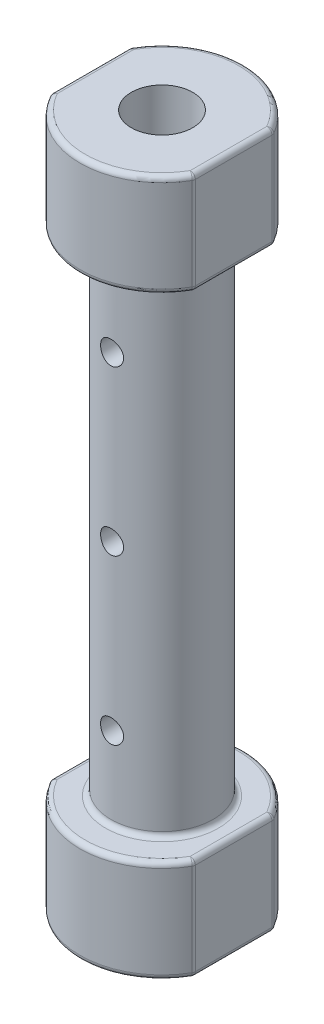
SolidWorks part; units mm, degrees
ref_plane "Front Plane" through (0, 0, 0) normal (0, 0, 1) x (1, 0, 0)
ref_plane "Top Plane" through (0, 0, 0) normal (0, 1, 0) x (1, 0, 0)
ref_plane "Right Plane" through (0, 0, 0) normal (1, 0, 0) x (0, 0, -1)
sketch "Sketch1" plane through (0, 0, 0) normal (0, 1, 0) x (1, 0, 0)
  circle A0 centre (0, 0) radius 7.9375
  dimension "D1" = 15.875
extrude "Boss-Extrude1" add sketch "Sketch1" along normal mid plane 76.2
sketch "Sketch2" plane through (0, 38.1, 0) normal (0, 1, 0) x (1, 0, 0)
  circle A0 centre (0, 0) radius 12.7
  dimension "D1" = 25.4
extrude "Boss-Extrude2" add sketch "Sketch2" along normal blind 15.875
mirror "Mirror1" about plane through (0, 0, 0) normal (0, 1, 0) of "Boss-Extrude2"
hole_wizard "3/8 (0.375) Diameter Hole1" positions "Sketch4" profile "Sketch3" hole size "3/8" standard "ANSI Inch"
sketch "Sketch4" plane through (0, 53.975, 0) normal (0, 1, 0) x (1, 0, 0)
  point P0 (0, 0)
sketch "Sketch3" plane through (0, 53.975, 0) normal (1, 0, 0) x (0, 0, 1)
  line L0 (0, 0) -> (0, 107.95)
  line L1 (0, 107.95) -> (4.7625, 107.95)
  line L2 (4.7625, 107.95) -> (4.7625, 0)
  line L5 (4.7625, 0) -> (0, 0)
  line L11 (0, -6.35) -> (0, 107.95) construction
  dimension "Thru Hole Dia." = 9.525
  dimension "Thru Hole Depth" = 107.95
sketch "Sketch5" plane through (0, 53.975, 0) normal (0, 1, 0) x (1, 0, 0)
  line L0 (-11.1125, 6.1484) -> (-11.1125, -6.1484)
  line L1 (11.1125, 6.1484) -> (11.1125, -6.1484)
  line L2 (0, 0) -> (0, -14.7079) construction
  circle A0 centre (0, 0) radius 12.7 construction
  arc A1 (-11.1125, 6.1484) -> (-11.1125, -6.1484) centre (0, 0) ccw
  arc A2 (11.1125, -6.1484) -> (11.1125, 6.1484) centre (0, 0) ccw
  dimension "D1" = 22.225
extrude "Cut-Extrude1" cut sketch "Sketch5" against normal through all
hole_wizard "9/64 (0.14063) Diameter Hole1" positions "3DSketch1" profile "Sketch7" hole size "9/64" standard "ANSI Inch"
sketch3d "3DSketch1"
  point P0 (0, 25.4, 7.9375)
  point P2 (0, 0, 7.9375)
  point P4 (0, -25.4, 7.9375)
  dimension "D1" = 25.4
sketch "Sketch7" plane through (0, 25.4, 7.9375) normal (1, 0, 0) x (0, -1, 0)
  line L0 (0, 0) -> (0, 3.175)
  line L1 (0, 3.175) -> (1.786, 3.175)
  line L2 (1.786, 3.175) -> (1.786, 0)
  line L5 (1.786, 0) -> (0, 0)
  line L11 (0, -6.35) -> (0, 107.95) construction
  dimension "Thru Hole Dia." = 3.572
  dimension "Thru Hole Depth" = 3.175
fillet "Fillet9" radius 0.7937 26 edges at (11.1125, 53.975, 0) (11.1125, 46.0375, -6.1484) (11.1125, 46.0375, 6.1484) (11.1125, 38.1, 0) (-11.1125, 53.975, 0) (-11.1125, 46.0375, 6.1484) (-11.1125, 46.0375, -6.1484) (-11.1125, 38.1, 0) (0, 38.1, -12.7) (0, 38.1, 12.7) (0, 53.975, -12.7) (0, 53.975, 12.7) (0, 38.1, 7.9375) (11.1125, -53.975, 0) (11.1125, -46.0375, 6.1484) (11.1125, -46.0375, -6.1484) (11.1125, -38.1, 0) (-11.1125, -53.975, 0) (-11.1125, -46.0375, -6.1484) (-11.1125, -46.0375, 6.1484) (-11.1125, -38.1, 0) (0, -38.1, 12.7) (0, -38.1, -12.7) (0, -53.975, 12.7) (0, -53.975, -12.7) (0, -38.1, -7.9375)
